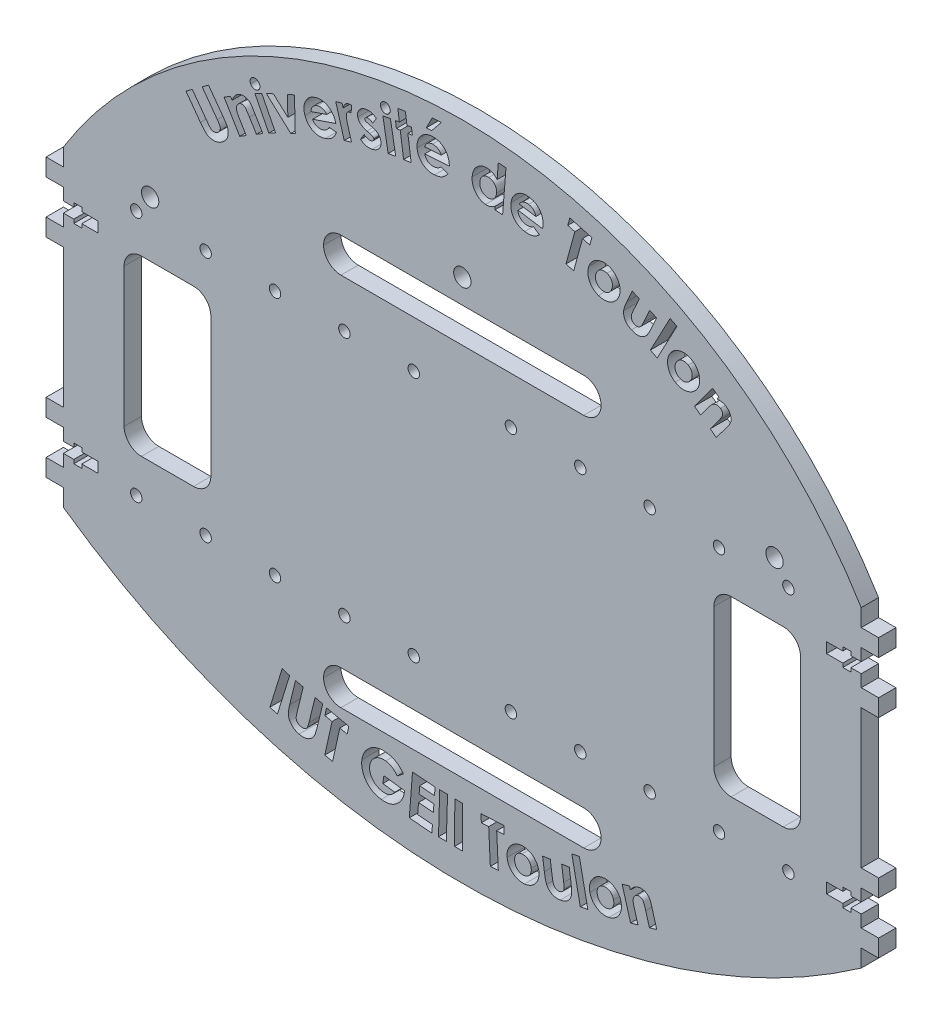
SolidWorks part; units mm, degrees
ref_plane "Plan de face" through (0, 0, 0) normal (0, 0, 1) x (1, 0, 0)
ref_plane "Plan de dessus" through (0, 0, 0) normal (0, 1, 0) x (1, 0, 0)
ref_plane "Plan de droite" through (0, 0, 0) normal (1, 0, 0) x (0, 0, -1)
sketch "Esquisse1" plane through (0, 0, 0) normal (0, 0, 1) x (1, 0, 0)
  line L0 (0, 45) -> (230, 45) construction
  line L1 (0, 0) -> (230, 0) construction
  line L2 (0, 0) -> (0, 90) construction
  line L3 (0, 90) -> (230, 90) construction
  line L4 (230, 0) -> (230, 90) construction
  line L5 (230, 65) -> (230, 25)
  line L6 (230, 5) -> (230, 0)
  line L7 (230, 85) -> (230, 90)
  line L8 (230, 75) -> (218.7792, 75) construction
  line L9 (230, 73.5) -> (230, 70)
  line L10 (235, 70) -> (235, 65)
  line L11 (235, 65) -> (230, 65)
  line L12 (235, 70) -> (230, 70)
  line L13 (230, 76.5) -> (230, 80)
  line L14 (230, 80) -> (235, 80)
  line L15 (235, 80) -> (235, 85)
  line L16 (235, 85) -> (230, 85)
  line L17 (230, 73.5) -> (230, 76.5) construction
  line L18 (230, 76.5) -> (227, 76.5)
  line L19 (224.7, 76.5) -> (224.7, 77.6)
  line L20 (227, 72.4) -> (224.7, 72.4)
  line L21 (227, 77.6) -> (227, 76.5)
  line L22 (224.7, 76.5) -> (220, 76.5)
  line L23 (220, 76.5) -> (220, 73.5)
  line L24 (220, 73.5) -> (224.7, 73.5)
  line L25 (227, 73.5) -> (227, 72.4)
  line L26 (224.7, 77.6) -> (227, 77.6)
  line L27 (224.7, 72.4) -> (224.7, 73.5)
  line L28 (227, 73.5) -> (230, 73.5)
  line L29 (220, 75) -> (230, 75) construction
  line L30 (230, 15) -> (218.7792, 15) construction
  line L31 (230, 13.5) -> (230, 10)
  line L32 (235, 10) -> (235, 5)
  line L33 (235, 5) -> (230, 5)
  line L34 (235, 10) -> (230, 10)
  line L35 (230, 16.5) -> (230, 20)
  line L36 (230, 20) -> (235, 20)
  line L37 (235, 20) -> (235, 25)
  line L38 (235, 25) -> (230, 25)
  line L39 (230, 13.5) -> (230, 16.5) construction
  line L40 (230, 16.5) -> (227, 16.5)
  line L41 (224.7, 16.5) -> (224.7, 17.6)
  line L42 (227, 12.4) -> (224.7, 12.4)
  line L43 (227, 17.6) -> (227, 16.5)
  line L44 (224.7, 16.5) -> (220, 16.5)
  line L45 (220, 16.5) -> (220, 13.5)
  line L46 (220, 13.5) -> (224.7, 13.5)
  line L47 (227, 13.5) -> (227, 12.4)
  line L48 (224.7, 17.6) -> (227, 17.6)
  line L49 (224.7, 12.4) -> (224.7, 13.5)
  line L50 (227, 13.5) -> (230, 13.5)
  line L51 (220, 15) -> (230, 15) construction
  line L52 (115, 0) -> (115, 90) construction
  line L53 (10, 15) -> (0, 15) construction
  line L54 (0, 13.5) -> (0, 16.5) construction
  line L55 (0, 15) -> (11.2208, 15) construction
  line L56 (10, 75) -> (0, 75) construction
  line L57 (0, 73.5) -> (0, 76.5) construction
  line L58 (0, 75) -> (11.2208, 75) construction
  line L59 (0, 0) -> (0, 90) construction
  line L60 (3, 13.5) -> (0, 13.5)
  line L61 (5.3, 12.4) -> (5.3, 13.5)
  line L62 (5.3, 17.6) -> (3, 17.6)
  line L63 (3, 13.5) -> (3, 12.4)
  line L64 (10, 13.5) -> (5.3, 13.5)
  line L65 (10, 16.5) -> (10, 13.5)
  line L66 (5.3, 16.5) -> (10, 16.5)
  line L67 (3, 17.6) -> (3, 16.5)
  line L68 (3, 12.4) -> (5.3, 12.4)
  line L69 (5.3, 16.5) -> (5.3, 17.6)
  line L70 (0, 16.5) -> (3, 16.5)
  line L71 (-5, 25) -> (0, 25)
  line L72 (-5, 20) -> (-5, 25)
  line L73 (0, 20) -> (-5, 20)
  line L74 (0, 16.5) -> (0, 20)
  line L75 (-5, 10) -> (0, 10)
  line L76 (-5, 5) -> (0, 5)
  line L77 (-5, 10) -> (-5, 5)
  line L78 (0, 13.5) -> (0, 10)
  line L79 (3, 73.5) -> (0, 73.5)
  line L80 (5.3, 72.4) -> (5.3, 73.5)
  line L81 (5.3, 77.6) -> (3, 77.6)
  line L82 (3, 73.5) -> (3, 72.4)
  line L83 (10, 73.5) -> (5.3, 73.5)
  line L84 (10, 76.5) -> (10, 73.5)
  line L85 (5.3, 76.5) -> (10, 76.5)
  line L86 (3, 77.6) -> (3, 76.5)
  line L87 (3, 72.4) -> (5.3, 72.4)
  line L88 (5.3, 76.5) -> (5.3, 77.6)
  line L89 (0, 76.5) -> (3, 76.5)
  line L90 (-5, 85) -> (0, 85)
  line L91 (-5, 80) -> (-5, 85)
  line L92 (0, 80) -> (-5, 80)
  line L93 (0, 76.5) -> (0, 80)
  line L94 (-5, 70) -> (0, 70)
  line L95 (-5, 65) -> (0, 65)
  line L96 (-5, 70) -> (-5, 65)
  line L97 (0, 73.5) -> (0, 70)
  line L98 (0, 85) -> (0, 90)
  line L99 (0, 5) -> (0, 0)
  line L100 (0, 65) -> (0, 25)
  line L101 (212.5, 24) -> (187.5, 24)
  line L102 (17.5, 74) -> (42.5, 74)
  line L103 (17.5, 74) -> (17.5, 24)
  line L104 (17.5, 24) -> (42.5, 24)
  line L105 (42.5, 74) -> (42.5, 24)
  line L106 (212.5, 74) -> (212.5, 24)
  line L107 (212.5, 74) -> (187.5, 74)
  line L108 (187.5, 74) -> (187.5, 24)
  line L110 (75, 108) -> (155, 108)
  line L111 (75, 108) -> (75, 98)
  line L112 (75, 98) -> (155, 98)
  line L113 (155, 108) -> (155, 98)
  line L114 (75, 0) -> (155, 0)
  line L115 (75, 0) -> (75, -10)
  line L116 (75, -10) -> (155, -10)
  line L117 (155, 0) -> (155, -10)
  circle A0 centre (25, 90) radius 2.5
  arc A1 (0, 90) -> (230, 90) centre (115, 19.2893) cw
  circle A2 centre (205, 90) radius 2.5
  circle A3 centre (115, 115) radius 2.5
  arc A4 (0, 0) -> (230, 0) centre (115, 163.6307) ccw
  line B0 (115, 88) -> (115, 10) construction
  line B1 (57.5, 88) -> (172.5, 88) construction
  line B2 (57.5, 10) -> (172.5, 10) construction
  circle B3 centre (61, 84.5) radius 1.65
  circle B4 centre (169, 84.5) radius 1.65
  circle B5 centre (169, 13.5) radius 1.65
  circle B6 centre (61, 13.5) radius 1.65
  circle B7 centre (81, 84.5) radius 1.65
  circle B8 centre (189, 84.5) radius 1.65
  circle B9 centre (189, 13.5) radius 1.65
  circle B10 centre (81, 13.5) radius 1.65
  circle B11 centre (101, 84.5) radius 1.65
  circle B12 centre (209, 84.5) radius 1.65
  circle B13 centre (209, 13.5) radius 1.65
  circle B14 centre (101, 13.5) radius 1.65
  circle B15 centre (41, 84.5) radius 1.65
  circle B16 centre (149, 84.5) radius 1.65
  circle B17 centre (149, 13.5) radius 1.65
  circle B18 centre (41, 13.5) radius 1.65
  line B19 (17.5, 49) -> (132.5, 49) construction
  circle B20 centre (21, 84.5) radius 1.65
  circle B21 centre (129, 84.5) radius 1.65
  circle B22 centre (129, 13.5) radius 1.65
  circle B23 centre (21, 13.5) radius 1.65
  dimension "D20" = 135
  dimension "D22" = 5
  dimension "D25" = 200
  dimension "D1" = 230
  dimension "D2" = 90
  dimension "D3" = 40
  dimension "D4" = 10
  dimension "D5" = 5
  dimension "D6" = 5
  dimension "D7" = 5.2
  dimension "D8" = 3
  dimension "D9" = 2.3
  dimension "D10" = 3
  dimension "D11" = 10
  dimension "D12" = 10
  dimension "D13" = 5
  dimension "D14" = 5
  dimension "D15" = 5.2
  dimension "D16" = 3
  dimension "D17" = 2.3
  dimension "D18" = 3
  dimension "D19" = 10
  dimension "D21" = 10
  dimension "D23" = 90
  dimension "D24" = 25
  dimension "D28" = 50
  dimension "D29" = 25
  dimension "D30" = 20
  dimension "D31" = 20
  dimension "D32" = 80
  dimension "D33" = 80
  dimension "D34" = 10
  dimension "D35" = 10
  dimension "D36" = 10
  dimension "D37" = 10
  dimension "D26" = 3
  dimension "D27" = 3
sketch_block_instance "Insert_LattePanda_Alpha-1"
sketch_block "Bloc1" parameters "D5"=3.3, "D1"=78, "D2"=115, "D3"=54, "D4"=35.5
sketch_block_instance "Bloc1-2"
sketch_block_instance "Bloc1-3"
sketch_block_instance "Bloc1-4"
sketch_block_instance "Bloc1-5"
extrude "Boss.-Extru.1" add sketch "Esquisse1" along normal blind 5
sketch "Esquisse3" plane through (0, 0, 5) normal (0, 0, 1) x (1, 0, 0)
  line L2 (0, 65) -> (0, 25) construction
  line L3 (230, 25) -> (230, 65) construction
  arc A2 (0, 10) -> (230, 10) centre (115, 163.6307) ccw construction
  arc A3 (0, 0) -> (230, 0) centre (115, 163.6307) ccw construction
  arc A4 (0, 45) -> (230, 45) centre (115, 19.2893) cw construction
  arc A5 (230, 90) -> (0, 90) centre (115, 19.2893) ccw construction
  text T0 "<b>IUT GEII Toulon</b>" font "Century Gothic" height 12
  text T1 "<b>Université de Toulon</b>" font "Century Gothic" height 12
extrude "Enlèv. mat.-Extru.1" cut sketch "Esquisse3" against normal blind 5
fillet "Congé1" radius 5 16 edges at (187.5, 24, 2.5) (187.5, 74, 2.5) (212.5, 74, 2.5) (212.5, 24, 2.5) (17.5, 24, 2.5) (42.5, 24, 2.5) (42.5, 74, 2.5) (17.5, 74, 2.5) (75, -10, 2.5) (155, -10, 2.5) (155, 0, 2.5) (75, 0, 2.5) (75, 98, 2.5) (155, 98, 2.5) (155, 108, 2.5) (75, 108, 2.5)
